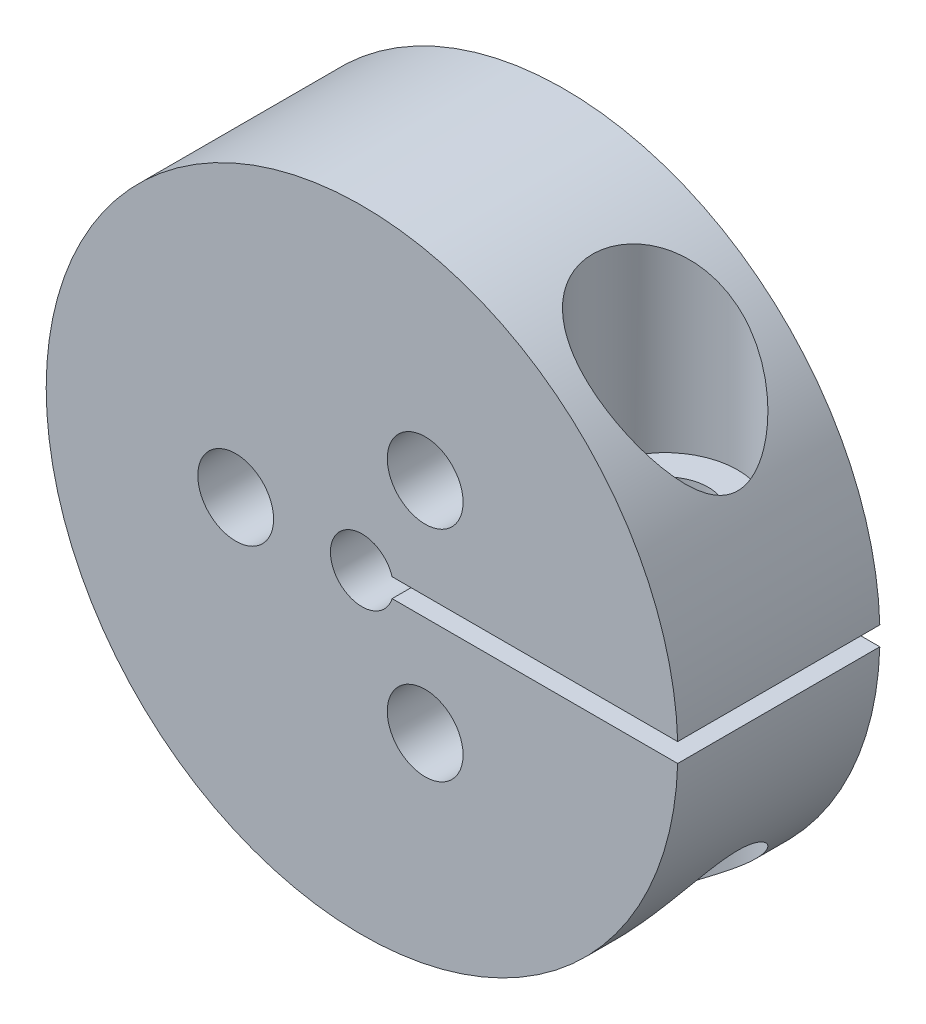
SolidWorks part; units mm, degrees
ref_plane "Front Plane" through (0, 0, 0) normal (0, 0, 1) x (1, 0, 0)
ref_plane "Top Plane" through (0, 0, 0) normal (0, 1, 0) x (1, 0, 0)
ref_plane "Right Plane" through (0, 0, 0) normal (1, 0, 0) x (0, 0, -1)
sketch "Sketch1" plane through (0, 0, 0) normal (0, 0, 1) x (1, 0, 0)
  line L0 (0, 0) -> (5.5204, 9.5617) construction
  line L1 (0, 0) -> (-7.7529, 0) construction
  line L2 (0, 0) -> (4.7704, -8.2626) construction
  line L3 (55, 0) -> (-55, 0) construction
  line L4 (0, -0.375) -> (12.4944, -0.375)
  line L5 (0, -0.375) -> (0, 0.375)
  line L6 (0, 0.375) -> (12.4944, 0.375)
  line L8 (0, -55) -> (0, 55) construction
  arc A0 (12.4944, 0.375) -> (12.4944, -0.375) centre (0, 0) ccw
  circle A1 centre (0, 0) radius 1.25
  circle A2 centre (2.5, 4.3301) radius 1.5
  circle A3 centre (2.5, -4.3301) radius 1.5
  circle A4 centre (-5, 0) radius 1.5
  circle A5 centre (0, 0) radius 5 construction
  point P14 (0, 0)
  dimension "D1" = 2.5
  dimension "D2" = 25
  dimension "D5" = 3
  dimension "D6" = 10
  dimension "D3" = 120
  dimension "D4" = 120
  dimension "D7" = 0.75
extrude "Boss-Extrude1" add sketch "Sketch1" along normal mid plane 8 contours A1 L6 A0 L4 A4 A3 A2
sketch "Sketch2" plane through (0, 0, 0) normal (0, 1, 0) x (1, 0, 0)
  line L0 (-13.7469, 0) -> (13.7469, 0) construction
  line L1 (0, -4.4) -> (0, 4.4) construction
  circle A0 centre (8, 0) radius 1.55
  dimension "D1" = 3.1
  dimension "D2" = 8
extrude "Cut-Extrude1" cut sketch "Sketch2" against normal through all and the other way through all contours A0
ref_plane "Plane1" through (0, 4, 0) normal (0, 1, 0) x (1, 0, 0)
sketch "Sketch3" plane through (0, 4, 0) normal (0, 1, 0) x (1, 0, 0)
  circle A0 centre (8, 0) radius 2.875
  dimension "D1" = 5.75
extrude "Cut-Extrude2" cut sketch "Sketch3" along normal through all
mirror "Mirror1" about plane through (0, 0, 0) normal (0, 1, 0) of "Cut-Extrude2"
sketch "Sketch4" plane through (0, 4, 0) normal (0, 1, 0) x (1, 0, 0)
  circle A0 centre (8, 0) radius 1.7
  dimension "D1" = 3.4
extrude "Cut-Extrude3" cut sketch "Sketch4" against normal up to next
